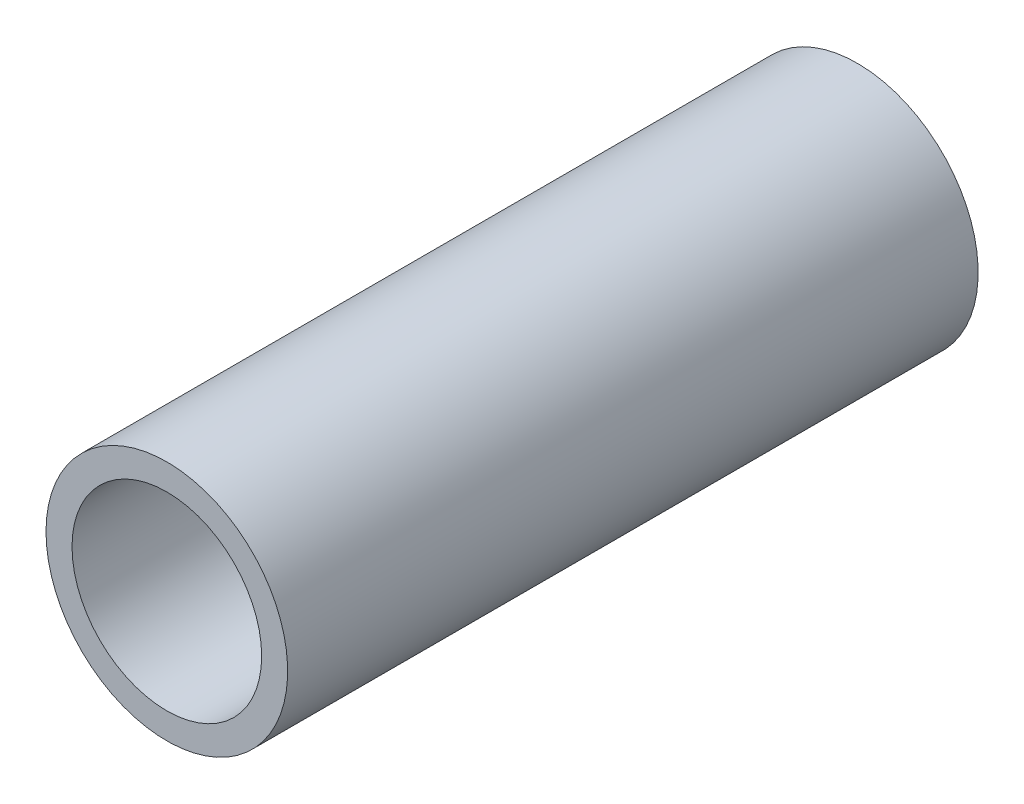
SolidWorks part; units mm, degrees
ref_plane "Front Plane" through (0, 0, 0) normal (0, 0, 1) x (1, 0, 0)
ref_plane "Top Plane" through (0, 0, 0) normal (0, 1, 0) x (1, 0, 0)
ref_plane "Right Plane" through (0, 0, 0) normal (1, 0, 0) x (0, 0, -1)
sketch "Sketch1" plane through (0, 0, 0) normal (0, 0, 1) x (1, 0, 0)
  circle A0 centre (0, 0) radius 13.335
  circle A1 centre (0, 0) radius 10.4648
  dimension "D1" = 26.67
  dimension "D2" = 2.8702
extrude "Extrude1" add sketch "Sketch1" along normal blind 76.2
